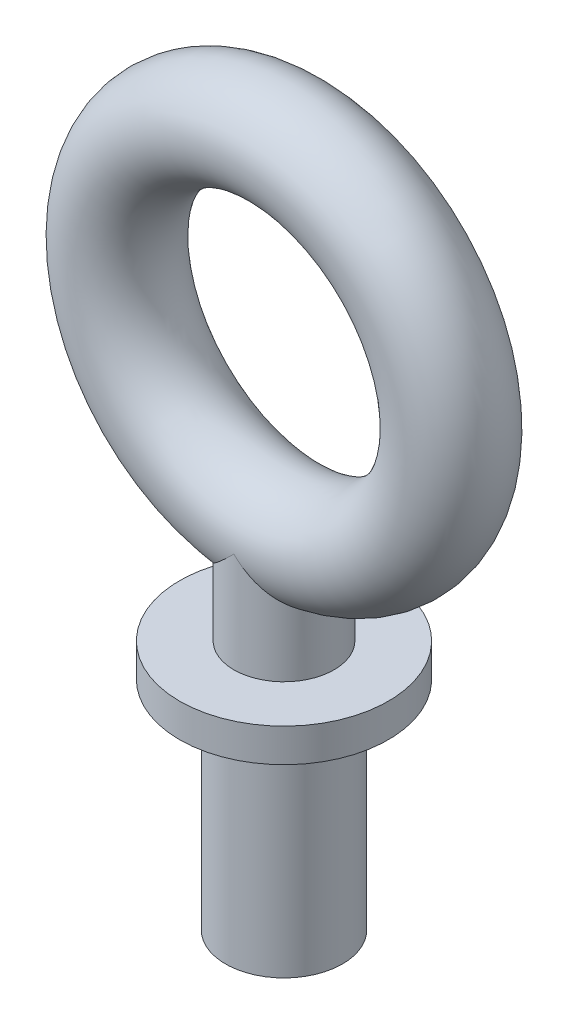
SolidWorks part; units mm, degrees
ref_plane "Front Plane" through (0, 0, 0) normal (0, 0, 1) x (1, 0, 0)
ref_plane "Top Plane" through (0, 0, 0) normal (0, 1, 0) x (1, 0, 0)
ref_plane "Right Plane" through (0, 0, 0) normal (1, 0, 0) x (0, 0, -1)
sketch "Sketch1" plane through (0, 0, 0) normal (0, 1, 0) x (1, 0, 0)
  line L0 (0, 0) -> (0, 43.8118) construction
  circle A0 centre (25.4, 0) radius 7.62
  dimension "D1" = 15.24
  dimension "D2" = 50.8
revolve "Revolve1" add sketch "Sketch1" angle 360 about L0
ref_plane "Plane1" through (0, -40.64, 0) normal (0, 1, 0) x (1, 0, 0)
sketch "Sketch2" plane through (0, -40.64, 0) normal (0, 1, 0) x (1, 0, 0)
  circle A0 centre (0, 0) radius 7.62
  dimension "D1" = 15.24
extrude "Boss-Extrude1" add sketch "Sketch2" along normal up to next
sketch "Sketch3" plane through (0, -40.64, 0) normal (0, -1, 0) x (1, 0, 0)
  circle A0 centre (0, 0) radius 15.875
  dimension "D1" = 31.75
extrude "Boss-Extrude2" add sketch "Sketch3" along normal blind 5.08
sketch "Sketch4" plane through (0, -45.72, 0) normal (0, -1, 0) x (1, 0, 0)
  circle A0 centre (0, 0) radius 8.89
  dimension "D1" = 17.78
extrude "Boss-Extrude3" add sketch "Sketch4" along normal blind 33.02
